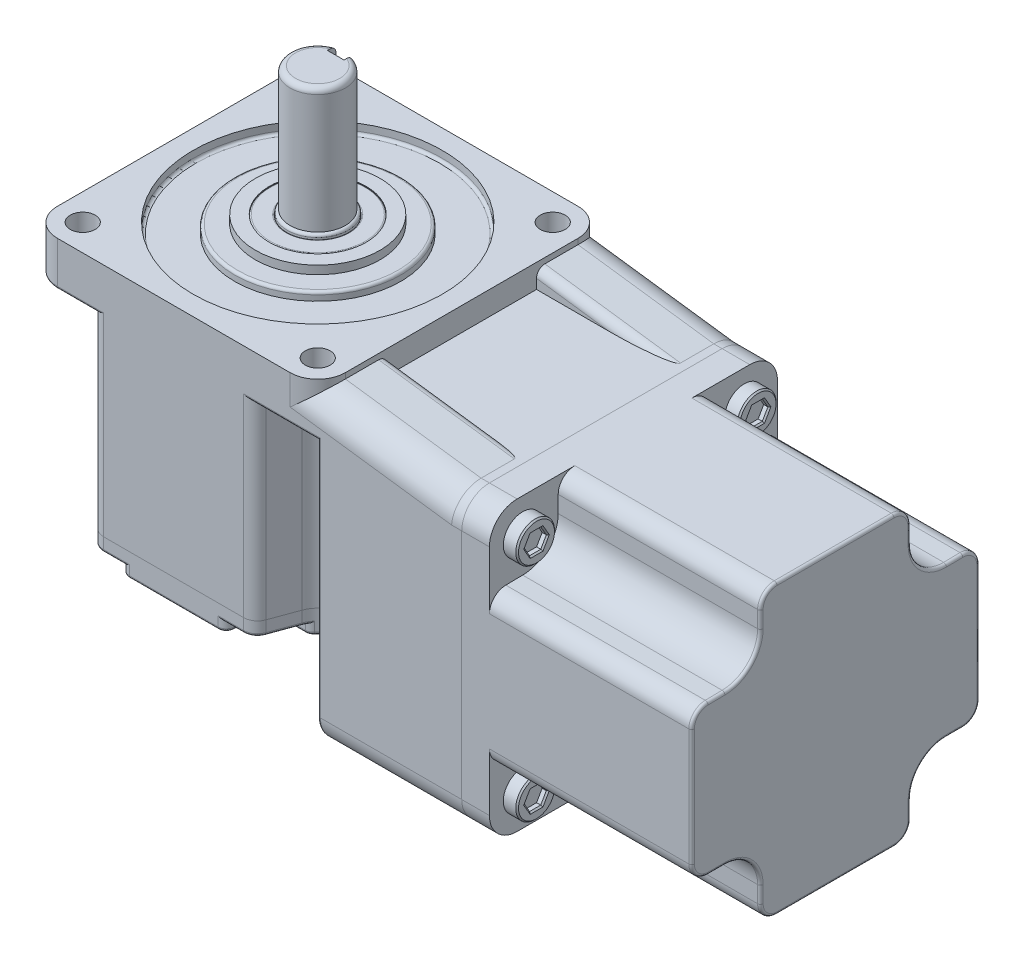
SolidWorks part; units mm, degrees
ref_plane "前视基准面" through (0, 0, 0) normal (0, 0, 1) x (1, 0, 0)
ref_plane "上视基准面" through (0, 0, 0) normal (0, 1, 0) x (1, 0, 0)
ref_plane "右视基准面" through (0, 0, 0) normal (1, 0, 0) x (0, 0, -1)
imported_body "100中实改进箱体-1-surface1"
imported_body "中实出轴-1-surface1"
imported_body "100中实改进箱盖-1-surface1"
imported_body "出轴油封-1-surface1"
sketch "草图1" plane through (69.065, 0, 0) normal (1, 0, 0) x (0, 0, -1)
  line L0 (27, 38.7179) -> (-27, 38.7179) construction
  line L1 (-42, -65.2821) -> (42, -65.2821)
  line L2 (-52, -55.2821) -> (-52, 28.7179)
  line L3 (-42, 38.7179) -> (42, 38.7179)
  line L4 (52, -55.2821) -> (52, 28.7179)
  line L5 (-52, -65.2821) -> (52, 38.7179) construction
  line L6 (-52, 38.7179) -> (52, -65.2821) construction
  arc A0 (-42, -65.2821) -> (-52, -55.2821) centre (-42, -55.2821) cw
  arc A1 (42, -65.2821) -> (52, -55.2821) centre (42, -55.2821) ccw
  arc A2 (42, 38.7179) -> (52, 28.7179) centre (42, 28.7179) cw
  arc A3 (-52, 28.7179) -> (-42, 38.7179) centre (-42, 28.7179) cw
  point P0 (0, -13.2821)
  dimension "D1" = 10
extrude "凸台-拉伸1" add sketch "草图1" along normal blind 83
sketch "草图2" plane through (152.065, 0, 0) normal (1, 0, 0) x (0, 0, -1)
  line L0 (-52, 28.7179) -> (-52, 7.8031)
  line L1 (-40, 13.8894) -> (-46.0858, 13.8024)
  line L2 (-42, 38.7179) -> (-21.1716, 38.7179)
  line L3 (21.0852, 38.7179) -> (42, 38.7179)
  line L5 (52, 28.7179) -> (52, 7.9781)
  line L6 (52, -34.4537) -> (52, -55.2821)
  line L7 (-52, 28.7179) -> (-52, -55.2821) construction
  line L9 (-46, -40.4537) -> (-40, -40.4537)
  line L11 (-27.1716, -53.2821) -> (-27.1716, -59.2821)
  line L12 (-42, -65.2821) -> (42, -65.2821) construction
  line L13 (42, -65.2821) -> (21.1716, -65.2821)
  line L14 (27.1716, -53.2821) -> (27.1716, -59.2821)
  line L16 (40, -40.4537) -> (46, -40.4537)
  line L17 (52, -55.2821) -> (52, 28.7179) construction
  line L19 (45.9107, 13.9775) -> (40, 13.8894)
  line L20 (-21.1716, -65.2821) -> (-42, -65.2821)
  line L21 (27.1716, 26.7179) -> (27.0846, 32.8037)
  line L23 (42, 38.7179) -> (-42, 38.7179) construction
  line L24 (-27.1716, 32.7179) -> (-27.1716, 26.7179)
  line L26 (-52, -55.2821) -> (-52, -34.4537)
  arc A0 (-40, 13.8894) -> (-27.1716, 26.7179) centre (-40, 26.7179) ccw
  arc A1 (27.1716, 26.7179) -> (40.382, 13.8951) centre (40, 26.7179) ccw
  arc A2 (40, -40.4537) -> (27.1716, -53.2821) centre (40, -53.2821) ccw
  arc A3 (-27.1716, -53.2821) -> (-40, -40.4537) centre (-40, -53.2821) ccw
  arc A4 (-21.1716, 38.7179) -> (-27.1716, 32.7179) centre (-21.1716, 32.7179) ccw
  arc A5 (27.0846, 32.8037) -> (21.0852, 38.7179) centre (21.0852, 32.7179) ccw
  arc A6 (52, 7.9781) -> (45.9107, 13.9775) centre (46, 7.9781) ccw
  arc A7 (27.1716, -59.2821) -> (21.1716, -65.2821) centre (21.1716, -59.2821) cw
  arc A8 (46, -40.4537) -> (52, -34.4537) centre (46, -34.4537) ccw
  arc A9 (-27.1716, -59.2821) -> (-21.1716, -65.2821) centre (-21.1716, -59.2821) ccw
  arc A10 (-52, -34.4537) -> (-46, -40.4537) centre (-46, -34.4537) ccw
  arc A11 (-46.0858, 13.8024) -> (-52, 7.8031) centre (-46, 7.8031) ccw
  arc A12 (-42, 38.7179) -> (-52, 28.7179) centre (-42, 28.7179) ccw
  arc A13 (52, 28.7179) -> (42, 38.7179) centre (42, 28.7179) ccw
  arc A14 (42, -65.2821) -> (52, -55.2821) centre (42, -55.2821) ccw
  arc A15 (-52, -55.2821) -> (-42, -65.2821) centre (-42, -55.2821) ccw
  point P0 (0, -13.2821)
  point P9 (-27.1716, 38.7179)
  point P36 (27, 38.7179)
  point P39 (52, 14.0682)
  point P42 (27.1716, -65.2821)
  point P45 (52, -40.4537)
  point P48 (-27.1716, -65.2821)
  point P51 (-52, -40.4537)
  dimension "D1" = 6
extrude "切除-拉伸1" cut sketch "草图2" against normal blind 73 contours A11 L1 A0 L24 A4 M6 M7 M8 | A6 A5 L21 A1 L19 M4 M5 M6 | A8 L16 A2 L14 A7 M2 M3 M4 | A10 A9 L11 A3 L9 M8 M1 M2
fillet "圆角1" radius 1 24 edges at (152.065, -13.3253, 52) (152.065, 12.0153, 50.2729) (152.065, 13.8459, 43.0429) (152.065, 17.6468, 30.9289) (152.065, 29.7179, 27.1716) (152.065, 36.9605, 25.4142) (152.065, 38.7179, 0.0432) (152.065, 36.9907, -25.2974) (152.065, 29.7608, -27.1281) (152.065, 17.6468, -30.9289) (152.065, 13.9335, -42.9553) (152.065, 12.2522, -50.2109) (152.065, -13.2378, -52) (152.065, -38.6963, -50.2426) (152.065, -40.4537, -43) (152.065, -44.2111, -30.9289) (152.065, -56.2821, -27.1716) (152.065, -63.5248, -25.4142) (152.065, -65.2821, 0) (152.065, -63.5248, 25.4142) (152.065, -56.2821, 27.1716) (152.065, -44.2111, 30.9289) (152.065, -40.4537, 43) (152.065, -38.6963, 50.2426)
sketch "草图4" plane through (79.065, 0, 0) normal (1, 0, 0) x (0, 0, -1)
  circle A0 centre (-40, 26.7179) radius 7
  circle A1 centre (40, 26.7179) radius 7
  circle A2 centre (40, -53.2821) radius 7
  circle A3 centre (-40, -53.2821) radius 7
extrude "凸台-拉伸2" add sketch "草图4" along normal blind 5
sketch "草图5" plane through (84.065, 0, 0) normal (1, 0, 0) x (0, 0, -1)
  line L1 (-35.9585, 26.7179) -> (-37.9793, 30.2179)
  line L2 (-37.9793, 30.2179) -> (-42.0207, 30.2179)
  line L3 (-42.0207, 30.2179) -> (-44.0415, 26.7179)
  line L4 (-44.0415, 26.7179) -> (-42.0207, 23.2179)
  line L5 (-42.0207, 23.2179) -> (-37.9793, 23.2179)
  line L6 (-37.9793, 23.2179) -> (-35.9585, 26.7179)
  line L7 (44.0415, 26.7179) -> (42.0207, 30.2179)
  line L8 (42.0207, 30.2179) -> (37.9793, 30.2179)
  line L9 (37.9793, 30.2179) -> (35.9585, 26.7179)
  line L10 (35.9585, 26.7179) -> (37.9793, 23.2179)
  line L11 (37.9793, 23.2179) -> (42.0207, 23.2179)
  line L12 (42.0207, 23.2179) -> (44.0415, 26.7179)
  line L13 (44.0415, -53.2821) -> (42.0207, -49.7821)
  line L14 (42.0207, -49.7821) -> (37.9793, -49.7821)
  line L15 (37.9793, -49.7821) -> (35.9585, -53.2821)
  line L16 (35.9585, -53.2821) -> (37.9793, -56.7821)
  line L17 (37.9793, -56.7821) -> (42.0207, -56.7821)
  line L18 (42.0207, -56.7821) -> (44.0415, -53.2821)
  line L19 (-35.9585, -53.2821) -> (-37.9793, -49.7821)
  line L20 (-37.9793, -49.7821) -> (-42.0207, -49.7821)
  line L21 (-42.0207, -49.7821) -> (-44.0415, -53.2821)
  line L22 (-44.0415, -53.2821) -> (-42.0207, -56.7821)
  line L23 (-42.0207, -56.7821) -> (-37.9793, -56.7821)
  line L24 (-37.9793, -56.7821) -> (-35.9585, -53.2821)
  circle A0 centre (-40, 26.7179) radius 3.5 construction
  circle A1 centre (40, 26.7179) radius 3.5 construction
  circle A2 centre (40, -53.2821) radius 3.5 construction
  circle A3 centre (-40, -53.2821) radius 3.5 construction
extrude "切除-拉伸2" cut sketch "草图5" against normal blind 2
chamfer "倒角1" distance 0.5 angle 45 7 edges at (84.065, 26.7179, 33) (84.065, 28.4679, 36.9689) (84.065, 30.2179, 40) (84.065, 28.4679, 43.0311) (84.065, 24.9679, 43.0311) (84.065, 23.2179, 40) (84.065, 24.9679, 36.9689)
chamfer "倒角2" distance 0.5 angle 45 21 edges at (84.065, -53.2821, 33) (84.065, -51.5321, 36.9689) (84.065, -49.7821, 40) (84.065, -51.5321, 43.0311) (84.065, -55.0321, 43.0311) (84.065, -56.7821, 40) (84.065, -55.0321, 36.9689) (84.065, -53.2821, -47) (84.065, -51.5321, -43.0311) (84.065, -49.7821, -40) (84.065, -51.5321, -36.9689) (84.065, -55.0321, -36.9689) (84.065, -56.7821, -40) (84.065, -55.0321, -43.0311) (84.065, 26.7179, -47) (84.065, 28.4679, -43.0311) (84.065, 30.2179, -40) (84.065, 28.4679, -36.9689) (84.065, 24.9679, -36.9689) (84.065, 23.2179, -40) (84.065, 24.9679, -43.0311)
